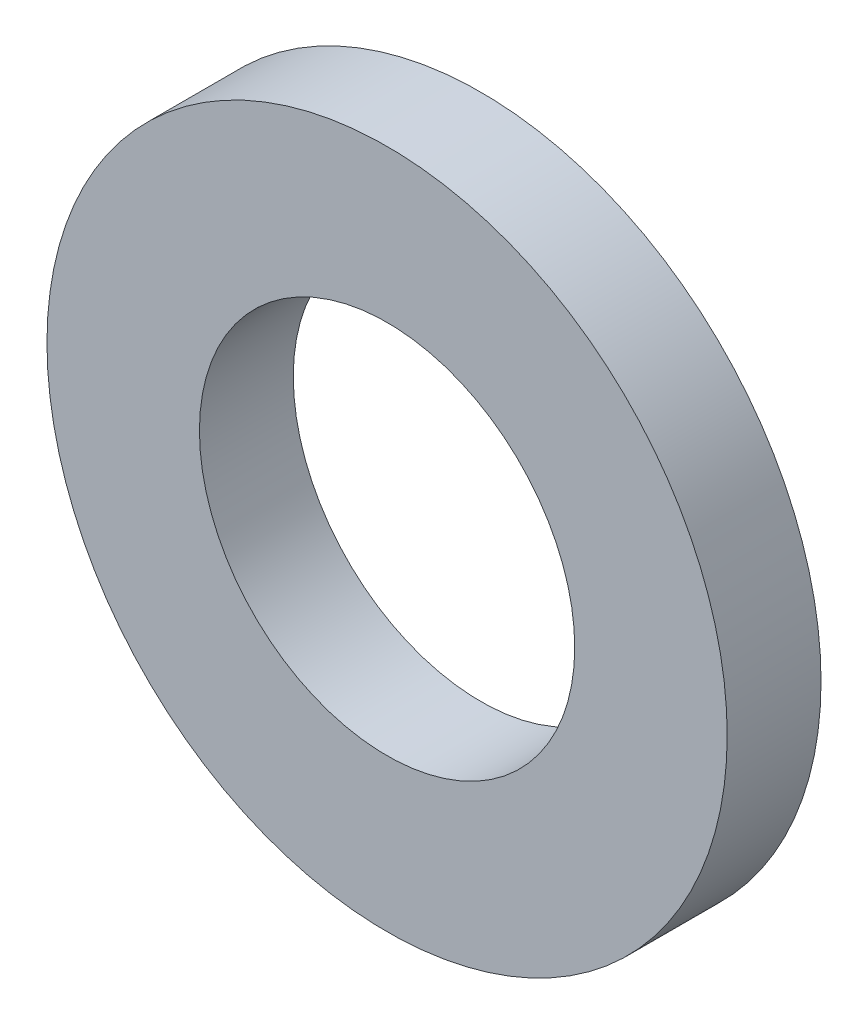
SolidWorks part; units mm, degrees
ref_plane "Plane1" through (0, 0, 0) normal (0, 0, 1) x (1, 0, 0)
ref_plane "Plane2" through (0, 0, 0) normal (0, 1, 0) x (1, 0, 0)
ref_plane "Plane3" through (0, 0, 0) normal (1, 0, 0) x (0, 0, -1)
sketch "Esquisse1" plane through (0, 0, 0) normal (0, 0, 1) x (1, 0, 0)
  circle A0 centre (0, 0) radius 2.9
  circle A1 centre (0, 0) radius 1.6
  dimension "D1" = 3.2
  dimension "D2" = 5.8
extrude "Base-Extrusion" add sketch "Esquisse1" along normal blind 0.8
